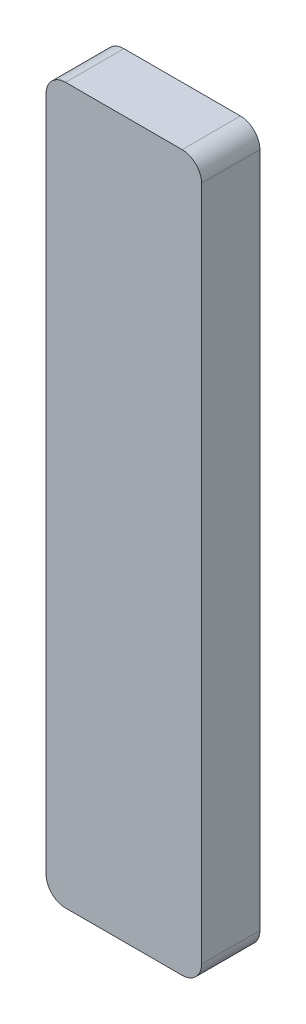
SolidWorks part; units mm, degrees
ref_plane "Front Plane" through (0, 0, 0) normal (0, 0, 1) x (1, 0, 0)
ref_plane "Top Plane" through (0, 0, 0) normal (0, 1, 0) x (1, 0, 0)
ref_plane "Right Plane" through (0, 0, 0) normal (1, 0, 0) x (0, 0, -1)
sketch "Sketch1" plane through (0, 0, 0) normal (0, 0, 1) x (1, 0, 0)
  line L1 (3, 18.4) -> (-3, 18.4)
  line L2 (4, 17.4) -> (4, -17.4)
  line L3 (3, -18.4) -> (-3, -18.4)
  line L4 (-4, 17.4) -> (-4, -17.4)
  line L5 (0, -18.4) -> (0, 18.4) construction
  line L6 (4, 0) -> (-4, 0) construction
  arc A0 (3, -18.4) -> (4, -17.4) centre (3, -17.4) ccw
  arc A1 (-3, -18.4) -> (-4, -17.4) centre (-3, -17.4) cw
  arc A2 (4, 17.4) -> (3, 18.4) centre (3, 17.4) ccw
  arc A3 (-4, 17.4) -> (-3, 18.4) centre (-3, 17.4) cw
  point P0 (0, 0)
  point P8 (-4, -18.4)
  point P11 (4, 18.4)
  point P14 (-4, 18.4)
  dimension "D3" = 1
  dimension "D1" = 36.8
  dimension "D2" = 8
extrude "Boss-Extrude1" add sketch "Sketch1" along normal blind 3
